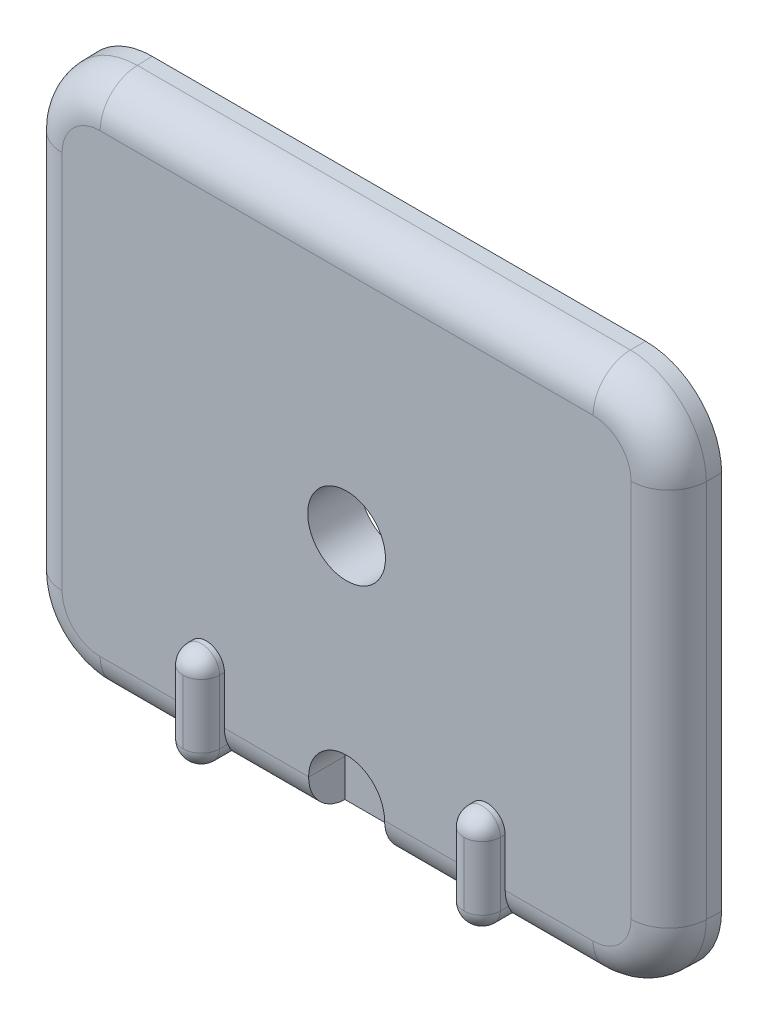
SolidWorks part; units mm, degrees
ref_plane "Front Plane" through (0, 0, 0) normal (0, 0, 1) x (1, 0, 0)
ref_plane "Top Plane" through (0, 0, 0) normal (0, 1, 0) x (1, 0, 0)
ref_plane "Right Plane" through (0, 0, 0) normal (1, 0, 0) x (0, 0, -1)
sketch "Sketch1" plane through (0, 0, 0) normal (0, 0, 1) x (1, 0, 0)
  line L1 (-13.4874, -11.1125) -> (13.4874, -11.1125)
  line L2 (-13.4874, -11.1125) -> (-13.4874, 11.1125)
  line L3 (-13.4874, 11.1125) -> (13.4874, 11.1125)
  line L4 (13.4874, -11.1125) -> (13.4874, 11.1125)
  line L5 (-13.4874, -11.1125) -> (13.4874, 11.1125) construction
  line L6 (-13.4874, 11.1125) -> (13.4874, -11.1125) construction
  circle A0 centre (0, 0) radius 12.5095 construction
  dimension "D1" = 25.019
  dimension "D2" = 22.225
  dimension "D3" = 26.9748
extrude "Boss-Extrude1" add sketch "Sketch1" along normal blind 2.1844 draft 1
fillet "Fillet3" radius 3.175 4 edges at (13.4683, -11.0934, 1.0922) (-13.4683, -11.0934, 1.0922) (-13.4683, 11.0934, 1.0922) (13.4683, 11.0934, 1.0922)
sketch "Sketch2" plane through (0, 0, 2.1844) normal (0, 0, 1) x (1, 0, 0)
  circle A0 centre (0, 0) radius 1.6256
  dimension "D1" = 3.2512
extrude "Cut-Extrude1" cut sketch "Sketch2" against normal through all
fillet "Fillet1" radius 1.5875 8 edges at (12.5195, 10.1446, 2.1844) (13.4493, 0, 2.1844) (12.5195, -10.1446, 2.1844) (0, -11.0744, 2.1844) (-12.5195, -10.1446, 2.1844) (-13.4493, 0, 2.1844) (-12.5195, 10.1446, 2.1844) (0, 11.0744, 2.1844)
sketch "Sketch3" plane through (0, 0, 2.1844) normal (0, 0, -1) x (-1, 0, 0)
  line L0 (5.8674, -7.493) -> (5.8674, -10.16) construction
  line L1 (6.6294, -7.493) -> (6.6294, -10.16)
  line L2 (5.1054, -7.493) -> (5.1054, -10.16)
  arc A0 (6.6294, -7.493) -> (5.1054, -7.493) centre (5.8674, -7.493) ccw
  arc A1 (5.1054, -10.16) -> (6.6294, -10.16) centre (5.8674, -10.16) ccw
  circle A2 centre (0, 0) radius 1.6256 construction
  point P2 (5.8674, -8.8265)
  dimension "D1" = 4.191
  dimension "D2" = 10.922
  dimension "D3" = 1.524
  dimension "D4" = 5.1054
extrude "Boss-Extrude2" add sketch "Sketch3" against normal blind 0.9652 and the other way up to surface
fillet "Fillet2" radius 0.762 4 edges at (-5.1054, -8.8265, 3.1496) (-5.8674, -6.731, 3.1496) (-6.6294, -8.8265, 3.1496) (-5.8674, -10.922, 3.1496)
mirror "Mirror1" about plane through (0, 0, 0) normal (1, 0, 0) of "Fillet2", "Boss-Extrude2"
sketch "Sketch4" plane through (0, 0, 2.1844) normal (0, 0, -1) x (-1, 0, 0)
  line L0 (0, 0) -> (0, -14.1119) construction
  line L1 (0, -13.6684) -> (0, -9.525) construction
  line L2 (-1.5875, -13.6684) -> (-1.5875, -9.525)
  line L3 (1.5875, -13.6684) -> (1.5875, -9.525)
  arc A0 (-1.5875, -13.6684) -> (1.5875, -13.6684) centre (0, -13.6684) ccw
  arc A1 (1.5875, -9.525) -> (-1.5875, -9.525) centre (0, -9.525) ccw
  point P5 (0, -11.5967)
  dimension "D2" = 9.525
  dimension "D1" = 3.175
extrude "Cut-Extrude2" cut sketch "Sketch4" along normal blind 1.524
